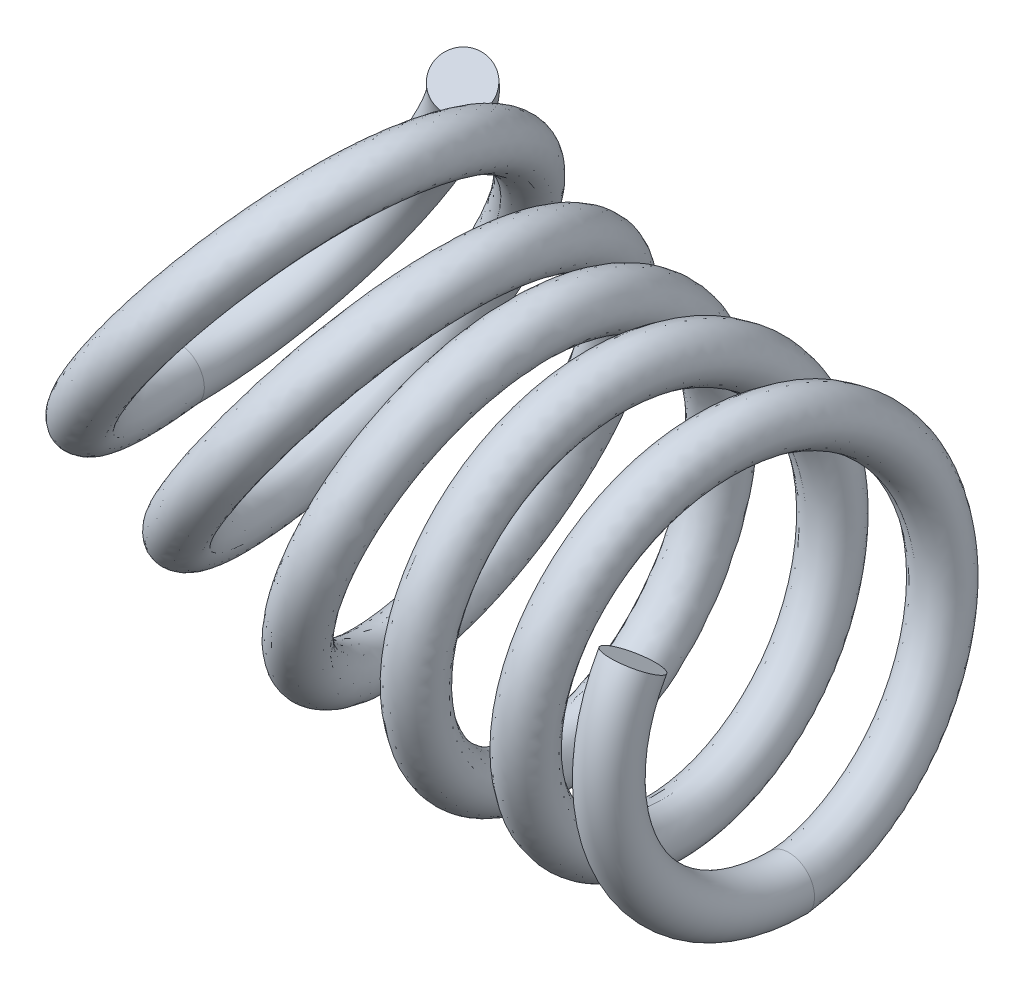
SolidWorks part; units mm, degrees
ref_plane "Спереди" through (0, 0, 0) normal (0, 0, 1) x (1, 0, 0)
ref_plane "Сверху" through (0, 0, 0) normal (0, 1, 0) x (1, 0, 0)
ref_plane "Справа" through (0, 0, 0) normal (1, 0, 0) x (0, 0, -1)
sketch "Эскиз1" plane through (0, 0, 0) normal (0, 0, 1) x (1, 0, 0)
  line L0 (3.6068, -1.9844) -> (3.6068, 1.9844) construction
  circle A0 centre (3.2004, -2.8448) radius 0.4064
  dimension "D1" = 0.8128
  dimension "D2" = 2.8448
sketch "Эскиз2" plane through (0, 0, 0) normal (0, 0, 1) x (1, 0, 0)
  line L0 (3.2004, 0) -> (0, 0)
  line L1 (-5.091, 1.8083) -> (-3.2571, 0.821)
  line L2 (-7.158, -1.0669) -> (-2.7996, 7.0293) construction
  line L4 (0, 1.1906) -> (0, -1.1906) construction
  arc A0 (-3.2571, 0.821) -> (0, 0) centre (0, 6.8713) ccw
  dimension "D1" = 2.54
  dimension "D2" = 0.4572
sweep "По траектории1" add profiles "Эскиз1" path "Эскиз2" parameters "D1"=1800
sketch "Эскиз3" plane through (0, 0, 0) normal (0, 0, -1) x (-1, 0, 0)
  line L0 (7.3203, 3.0084) -> (3.8015, 1.1141) construction
  line L1 (5.091, 1.8083) -> (3.2571, 0.821) construction
  circle A0 centre (6.4395, -0.6966) radius 0.4064 construction
  circle A1 centre (6.4395, -0.6966) radius 0.4064
revolve "Повернуть1" add sketch "Эскиз3" angle 120 about L0
sketch "Эскиз4" plane through (0, 0, 0) normal (0, 0, 1) x (1, 0, 0)
  line L0 (0.671, 0) -> (2.8207, 0) construction
  line L1 (3.2004, 0) -> (0, 0) construction
  circle A1 centre (3.2004, -2.8448) radius 0.4064
  circle A2 centre (3.2004, -2.8448) radius 0.4064
  dimension "D1" = 0
revolve "Повернуть2" add sketch "Эскиз4" angle 120 about L0
